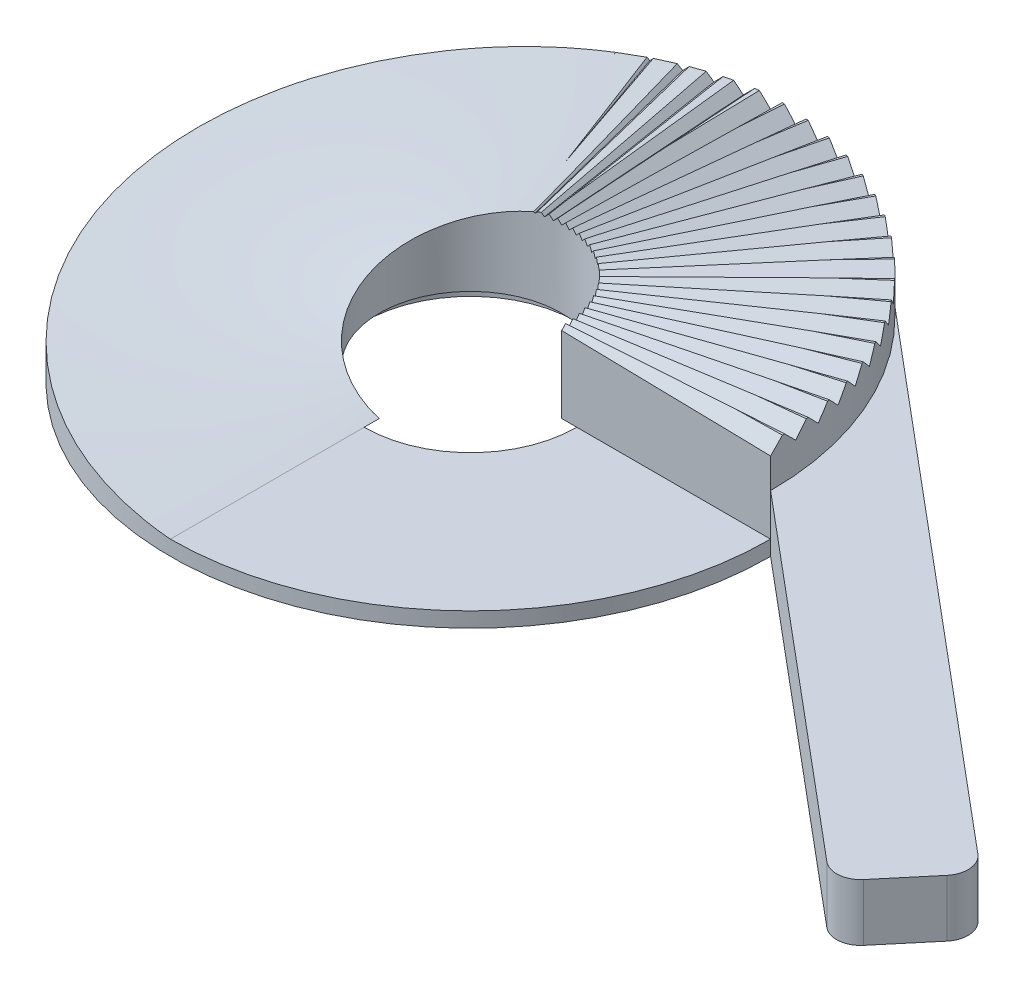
SolidWorks part; units mm, degrees
ref_plane "Front Plane" through (0, 0, 0) normal (0, 0, 1) x (1, 0, 0)
ref_plane "Top Plane" through (0, 0, 0) normal (0, 1, 0) x (1, 0, 0)
ref_plane "Right Plane" through (0, 0, 0) normal (1, 0, 0) x (0, 0, -1)
sketch "Sketch1" plane through (0, 0, 0) normal (0, 1, 0) x (1, 0, 0)
  circle A0 centre (0, 0) radius 31.75
  circle A1 centre (0, 0) radius 8.128
  dimension "D1" = 63.5
  dimension "D2" = 16.256
extrude "Boss-Extrude1" add sketch "Sketch1" along normal blind 6.35
sketch "Sketch2" plane through (0, 6.35, 0) normal (0, 1, 0) x (1, 0, 0)
  circle A1 centre (0, 0) radius 34.925
  dimension "D1" = 69.85
sketch "Sketch6" plane through (0, 6.35, 0) normal (0, 1, 0) x (1, 0, 0)
  circle A0 centre (0, 0) radius 31.75
  circle A1 centre (0, 0) radius 8.001
extrude "Boss-Extrude2" add sketch "Sketch6" along normal blind 13.97
curve "Helix/Spiral1"
sketch "Sketch7" plane through (0, 0, 0) normal (1, 0, 0) x (0, 0, -1)
  line L1 (34.925, 15.24) -> (6.35, 15.24)
  line L2 (34.925, 15.24) -> (34.925, 29.21)
  line L3 (34.925, 29.21) -> (6.35, 29.21)
  line L4 (6.35, 15.24) -> (6.35, 29.21)
  line L5 (8.001, 20.32) -> (-8.001, 20.32) construction
  line L6 (8.001, 20.32) -> (-8.001, 20.32) construction
  point P10 (0, 20.32)
  dimension "D1" = 13.97
  dimension "D2" = 6.35
  dimension "D3" = 28.575
  dimension "D4" = 15.24
sketch "Sketch5" plane through (0, 0, 0) normal (1, 0, 0) x (0, 0, -1)
  line L1 (-34.925, 20.32) -> (-6.35, 20.32)
  line L2 (-34.925, 20.32) -> (-34.925, 6.35)
  line L3 (-34.925, 6.35) -> (-6.35, 6.35)
  line L4 (-6.35, 20.32) -> (-6.35, 6.35)
  line L5 (8.001, 20.32) -> (-8.001, 20.32) construction
  line L6 (8.001, 20.32) -> (-6.35, 20.32) construction
  point P4 (0, 0)
  point P6 (0, 0)
  dimension "D1" = 28.575
  dimension "D2" = 13.97
  dimension "D3" = 6.35
sketch "Sketch8" plane through (0, 20.32, 0) normal (0, 1, 0) x (1, 0, 0)
  circle A0 centre (0, 0) radius 34.925
  dimension "D1" = 69.85
curve "Helix/Spiral3"
sketch "Sketch9" plane through (0, 20.32, 0) normal (0, 1, 0) x (1, 0, 0)
  circle A0 centre (0, 0) radius 6.35
  dimension "D1" = 12.7
curve "Helix/Spiral4"
ref_plane "Plane1" through (0, 6.35, 0) normal (0, -1, 0) x (-1, 0, 0)
sketch "Sketch11" plane through (0, 6.35, 0) normal (0, -1, 0) x (-1, 0, 0)
  circle A0 centre (0, 0) radius 6.35
  dimension "D1" = 12.7
curve "Helix/Spiral6"
sketch "Sketch12" plane through (0, 20.32, 0) normal (0, 1, 0) x (1, 0, 0)
  line L1 (0, -8.001) -> (0, -31.75)
  line L3 (8.001, 0) -> (31.75, 0)
  arc A0 (0, -8.001) -> (8.001, 0) centre (0, 0) ccw
  arc A1 (0, -31.75) -> (31.75, 0) centre (0, 0) ccw
loft "Cut-Loft7" cut profiles "Sketch5", "Sketch7"
extrude "Cut-Extrude2" cut sketch "Sketch12" against normal blind 13.97 contours L3 A1 L1 A0
ref_plane "Plane2" through (31.75, 0, 0) normal (1, 0, 0) x (0, 0, -1)
sketch "Sketch13" plane through (31.75, 0, 0) normal (1, 0, 0) x (0, 0, -1)
  line L0 (0, 13.97) -> (1.27, 15.24)
  line L1 (0, 6.35) -> (0, 20.32) construction
  line L6 (0, 13.97) -> (-1.27, 15.24)
  line L7 (1.27, 15.24) -> (-1.27, 15.24)
  dimension "D1" = 15.24
  dimension "D2" = 2.54
  dimension "D3" = 1.27
  dimension "D4" = 1.27
sketch "Sketch14" plane through (0, 0, 0) normal (1, 0, 0) x (0, 0, -1)
  line L1 (-0.635, 15.24) -> (0.635, 15.24)
  line L3 (0.635, 15.24) -> (0, 14.605)
  line L4 (0, 6.35) -> (0, 20.32) construction
  line L5 (0, 14.605) -> (-0.635, 15.24)
  dimension "D1" = 1.27
  dimension "D2" = 0.635
  dimension "D3" = 0.635
  dimension "D4" = 15.24
loft "Cut-Loft8" cut profiles "Sketch14", "Sketch13"
sketch "Sketch15" plane through (0, 0, 0) normal (0, -1, 0) x (1, 0, 0)
  line L0 (31.75, 0) -> (70.6651, 32.6536)
  line L1 (70.6651, 32.6536) -> (77.9552, 23.9655)
  line L2 (77.9552, 23.9655) -> (20.4085, -24.3219)
  line L3 (31.75, 0) -> (8.001, 0) construction
  line L4 (31.75, 0) -> (8.001, 0) construction
  circle A0 centre (0, 0) radius 31.75 construction
  arc A2 (20.4085, -24.3219) -> (31.75, 0) centre (0, 0) ccw
  point P10 (0, 0)
  dimension "D1" = 50.8
  dimension "D2" = 40
extrude "Boss-Extrude3" add sketch "Sketch15" against normal up to vertex contours L0 L1 L2 A2
sketch "Sketch16" plane through (0, 0, 0) normal (0, 0, 1) x (1, 0, 0)
  line L4 (-31.75, 0) -> (31.75, 0) construction
  line L5 (0, -1.1713) -> (0, 25.1322) construction
  line L6 (0, 22.9068) -> (0, 0)
  line L7 (0, 0) -> (11.1506, 0)
  line L8 (11.1506, 0) -> (11.1506, 1.651)
  line L9 (11.1506, 1.651) -> (9.652, 1.651)
  line L10 (9.652, 1.651) -> (9.652, 22.9068)
  line L11 (9.652, 22.9068) -> (0, 22.9068)
  dimension "D1" = 1.651
  dimension "D2" = 22.3012
  dimension "D3" = 19.304
revolve "Cut-Revolve1" cut sketch "Sketch16" angle 360 about L5
sketch "Sketch17" plane through (0, 20.32, 0) normal (0, 1, 0) x (1, 0, 0)
  line L2 (9.652, 0) -> (31.75, 0)
  line L3 (0, 31.75) -> (0, 9.652)
  line L4 (9.652, 0) -> (31.75, 0)
  line L5 (0, 31.75) -> (0, 9.652)
  arc A2 (9.652, 0) -> (0, 9.652) centre (0, 0) ccw
  arc A3 (31.75, 0) -> (0, 31.75) centre (0, 0) ccw
  arc A4 (9.652, 0) -> (0, 9.652) centre (0, 0) ccw
  arc A5 (31.75, 0) -> (0, 31.75) centre (0, 0) ccw
  dimension "D1" = 0
extrude "Cut-Extrude3" cut sketch "Sketch17" against normal blind 5.08
pattern_circular "CirPattern1" count 25 every 5 about axis through (0, 0, 0) along (0, 1, 0) of "Cut-Loft8"
fillet "Fillet1" radius 2.54 2 edges at (70.6651, 6.985, 32.6536) (77.9552, 6.985, 23.9655)
sketch "Sketch18" plane through (0, 0, 0) normal (0, -1, 0) x (1, 0, 0)
  line L1 (-59.6397, 48.9058) -> (96.2016, 48.9058)
  line L2 (-59.6397, 48.9058) -> (-59.6397, -36.4253)
  line L3 (-59.6397, -36.4253) -> (96.2016, -36.4253)
  line L4 (96.2016, 48.9058) -> (96.2016, -36.4253)
extrude "Cut-Extrude4" cut sketch "Sketch18" against normal blind 4.7625 contours L1 L4 L3 L2
sketch "Sketch19" plane through (0, 4.7625, 0) normal (0, -1, 0) x (-1, 0, 0)
  circle A0 centre (0, 0) radius 11.25
  dimension "D1" = 22.5
extrude "Cut-Extrude5" cut sketch "Sketch19" against normal blind 1.5875 contours A0
sketch "Sketch20" plane through (0, 13.97, 0) normal (0, 1, 0) x (1, 0, 0)
  line L3 (31.75, 0) -> (68.7193, -31.0209)
  line L4 (72.2977, -30.7079) -> (76.3225, -25.9113)
  line L5 (76.0095, -22.3328) -> (20.4085, 24.3219)
  line L6 (31.75, 0) -> (68.7193, -31.0209)
  line L7 (72.2977, -30.7079) -> (76.3225, -25.9113)
  line L8 (76.0095, -22.3328) -> (20.4085, 24.3219)
  arc A10 (31.6292, 2.7672) -> (31.2676, 5.5133) centre (0, 0) ccw
  arc A11 (31.6292, 2.7672) -> (31.2676, 5.5133) centre (0, 0) ccw
  arc A12 (31.75, 0) -> (31.6292, 2.7672) centre (0, 0) ccw
  arc A13 (31.75, 0) -> (31.6292, 2.7672) centre (0, 0) ccw
  arc A16 (68.7193, -31.0209) -> (72.2977, -30.7079) centre (70.352, -29.0752) ccw
  arc A17 (68.7193, -31.0209) -> (72.2977, -30.7079) centre (70.352, -29.0752) ccw
  arc A18 (76.3225, -25.9113) -> (76.0095, -22.3328) centre (74.3768, -24.2786) ccw
  arc A19 (76.3225, -25.9113) -> (76.0095, -22.3328) centre (74.3768, -24.2786) ccw
  arc A20 (22.4506, 22.4506) -> (20.4085, 24.3219) centre (0, 0) ccw
  arc A27 (24.3219, 20.4085) -> (22.4506, 22.4506) centre (0, 0) ccw
  arc A28 (26.0081, 18.2111) -> (24.3219, 20.4085) centre (0, 0) ccw
  arc A29 (27.4963, 15.875) -> (26.0081, 18.2111) centre (0, 0) ccw
  arc A30 (28.7753, 13.4181) -> (27.4963, 15.875) centre (0, 0) ccw
  arc A31 (29.8352, 10.8591) -> (28.7753, 13.4181) centre (0, 0) ccw
  arc A32 (30.6681, 8.2175) -> (29.8352, 10.8591) centre (0, 0) ccw
  arc A33 (31.2676, 5.5133) -> (30.6681, 8.2175) centre (0, 0) ccw
  arc A38 (22.4506, 22.4506) -> (20.4085, 24.3219) centre (0, 0) ccw
  arc A45 (24.3219, 20.4085) -> (22.4506, 22.4506) centre (0, 0) ccw
  arc A46 (26.0081, 18.2111) -> (24.3219, 20.4085) centre (0, 0) ccw
  arc A47 (27.4963, 15.875) -> (26.0081, 18.2111) centre (0, 0) ccw
  arc A48 (28.7753, 13.4181) -> (27.4963, 15.875) centre (0, 0) ccw
  arc A49 (29.8352, 10.8591) -> (28.7753, 13.4181) centre (0, 0) ccw
  arc A50 (30.6681, 8.2175) -> (29.8352, 10.8591) centre (0, 0) ccw
  arc A51 (31.2676, 5.5133) -> (30.6681, 8.2175) centre (0, 0) ccw
  dimension "D1" = 0
extrude "Cut-Extrude6" cut sketch "Sketch20" against normal blind 3.175
